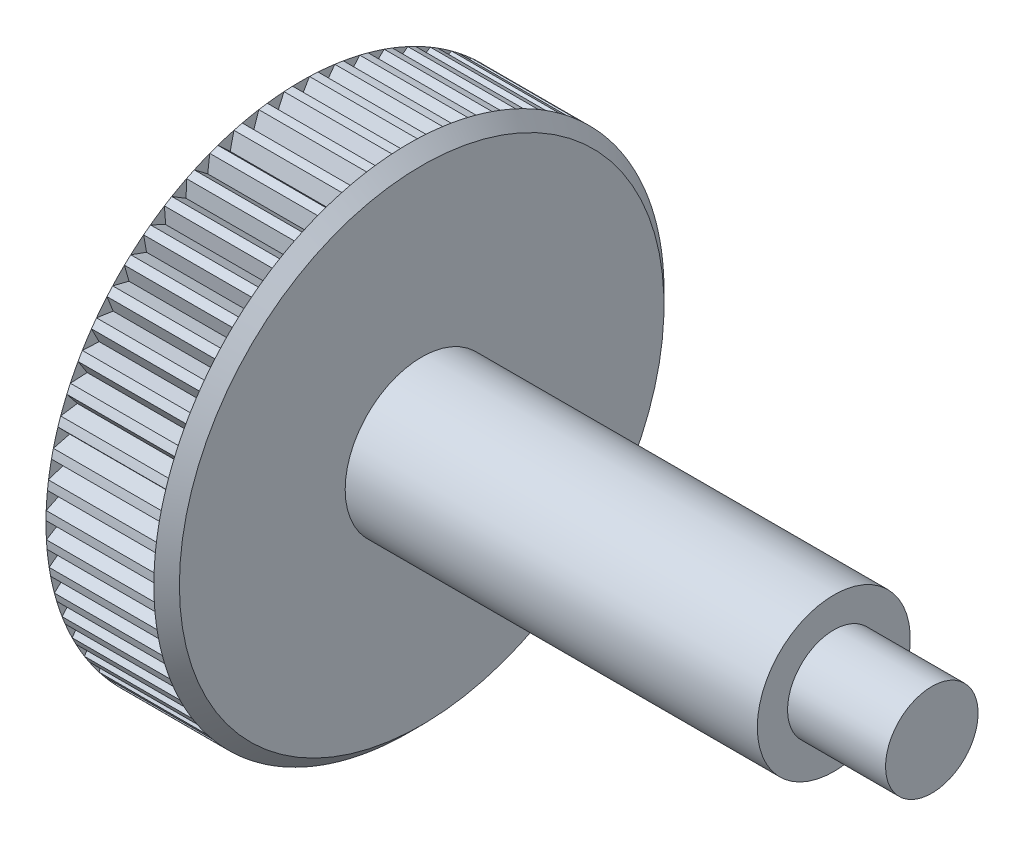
SolidWorks part; units mm, degrees
ref_plane "Front" through (0, 0, 0) normal (0, 0, 1) x (1, 0, 0)
ref_plane "Top" through (0, 0, 0) normal (0, 1, 0) x (1, 0, 0)
ref_plane "Right" through (0, 0, 0) normal (1, 0, 0) x (0, 0, -1)
sketch "Sketch1" plane through (0, 0, 0) normal (0, 0, 1) x (1, 0, 0)
  line L0 (0, 0) -> (26, 0)
  line L1 (1.2702, 10) -> (6, 10)
  line L2 (6, 10) -> (6, 3)
  line L3 (26, 0) -> (26, 1.814)
  line L4 (22.1577, 3) -> (22.1577, 1.814)
  line L5 (22.1577, 1.814) -> (26, 1.814)
  line L7 (6, 3) -> (22.1577, 3)
  line L9 (-48.2111, 0) -> (101.1311, 0) construction
  arc A1 (1.2702, 10) -> (0, 0) centre (40, 0) ccw
  dimension "dr" = 40
  dimension "dk" = 20
  dimension "d" = 6
  dimension "k" = 6
  dimension "l" = 20
  dimension "z" = 3.8423
  dimension "dp" = 3.6281
revolve "Base" add sketch "Sketch1" angle 360 about L9
chamfer "Chamfer1" distance 0.5 angle 45 1 edges at (6, 0, 10)
ref_plane "Plane1" through (1.2702, 0, 0) normal (1, 0, 0) x (0, 0, -1)
ref_plane "Plane2" through (5.5, 0, 0) normal (1, 0, 0) x (0, 0, -1)
sketch "Sketch2" plane through (1.2702, 0, 0) normal (1, 0, 0) x (0, 0, -1)
  line L1 (0, 9.4226) -> (0.5, 10.2887)
  line L2 (0.5, 10.2887) -> (-0.5, 10.2887)
  line L3 (-0.5, 10.2887) -> (0, 9.4226)
  circle A0 centre (0, 0) radius 10 construction
  circle A2 centre (0, 10) radius 0.2887 construction
  dimension "D1" = 1
extrude "Cut-Extrude1" cut sketch "Sketch2" along normal up to surface (4.2298 mm away)
pattern_circular "Circular-Pattern1" count 63 over 360 about axis through (0, 0, 0) along (1, 0, 0) of "Cut-Extrude1"
sketch "Sketch3" plane through (0, 0, 0) normal (0, 0, 1) x (1, 0, 0)
  line L0 (21.7827, 3.75) -> (22.5327, 3.75)
  line L1 (22.5327, 3.75) -> (22.5327, 3)
  line L2 (22.5327, 3) -> (22.1577, 2.3505)
  line L3 (22.1577, 2.3505) -> (21.7827, 3)
  line L4 (21.7827, 3) -> (21.7827, 3.75)
  line L5 (22.1577, -3) -> (22.1577, 3) construction
  line L6 (22.1577, 3) -> (6, 3) construction
  dimension "D1" = 0.75
revolve "Cut-Revolve10" [suppressed] cut sketch "Sketch3" angle 360 about axis through (-48.2111, 0, 0) along (1, 0, 0)
pattern_linear "LPattern10" [suppressed] count 18 along (1, 0, 0)
equation "\"D1@Circular-Pattern1\" =int (  \"dk@Sketch1\" * PI+1 ) "
equation "\"D1@Plane2\" = \"c@Chamfer1\""
equation "\"D1@Sketch3\" =  ( \"d@Sketch1\" - \"THD_MINOR@ThreadCosmetic1\" )  / 2"
equation "\"pitch@LPattern10\" = 1.2 * \"D1@Sketch3\""
equation "\"D1@LPattern10\" =  ( \"l@Sketch1\" - \"z@Sketch1\" )  / \"pitch@LPattern10\""
